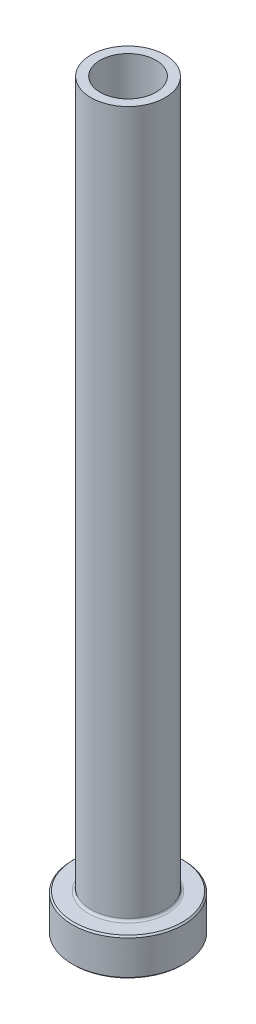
SolidWorks part; units mm, degrees
ref_plane "Front Plane" through (0, 0, 0) normal (0, 0, 1) x (1, 0, 0)
ref_plane "Top Plane" through (0, 0, 0) normal (0, 1, 0) x (1, 0, 0)
ref_plane "Right Plane" through (0, 0, 0) normal (1, 0, 0) x (0, 0, -1)
sketch "Sketch1" plane through (0, 0, 0) normal (0, 0, 1) x (1, 0, 0)
  line L0 (0, 0) -> (0, 50000) construction
  line L1 (0, 0) -> (9.525, 0)
  line L2 (9.525, 0) -> (9.525, 6.35)
  line L3 (9.525, 6.35) -> (6.7405, 6.35)
  line L4 (6.3436, 6.7469) -> (6.3436, 127)
  line L5 (6.3436, 127) -> (0, 127)
  line L6 (0, 127) -> (0, 0)
  arc A0 (6.3436, 6.7469) -> (6.7405, 6.35) centre (6.7405, 6.7469) ccw
  dimension "D5" = 0.3969
  dimension "D1" = 12.6873
  dimension "D2" = 19.05
  dimension "D3" = 6.35
  dimension "D4" = 127
revolve "Revolve1" add sketch "Sketch1" angle 360 about L0
sketch "Sketch2" plane through (0, 0, 0) normal (0, 0, 1) x (1, 0, 0)
  line L0 (0, 0) -> (0, 50000) construction
  line L1 (-9.525, 0) -> (9.525, 0) construction
  line L2 (5.3499, 0) -> (4.953, 0.3969)
  line L3 (4.953, 0.3969) -> (4.953, 52.5145)
  line L4 (4.953, 52.5145) -> (4.7625, 66.802)
  line L5 (4.7625, 66.802) -> (4.7625, 127)
  line L6 (6.3436, 127) -> (-6.3436, 127) construction
  line L7 (4.7625, 127) -> (0, 127)
  line L8 (0, 127) -> (0, 0)
  line L9 (0, 0) -> (5.3499, 0)
  point P4 (0, 0)
  dimension "D1" = 0.3969
  dimension "D2" = 45
  dimension "D3" = 9.525
  dimension "D4" = 9.906
  dimension "D5" = 60.198
  dimension "D6" = 14.2875
revolve "Cut-Revolve1" cut sketch "Sketch2" angle 360 about L0
chamfer "Chamfer1" distance 0.254 angle 45 2 edges at (0, 0, -9.525) (0, 6.35, -9.525)
